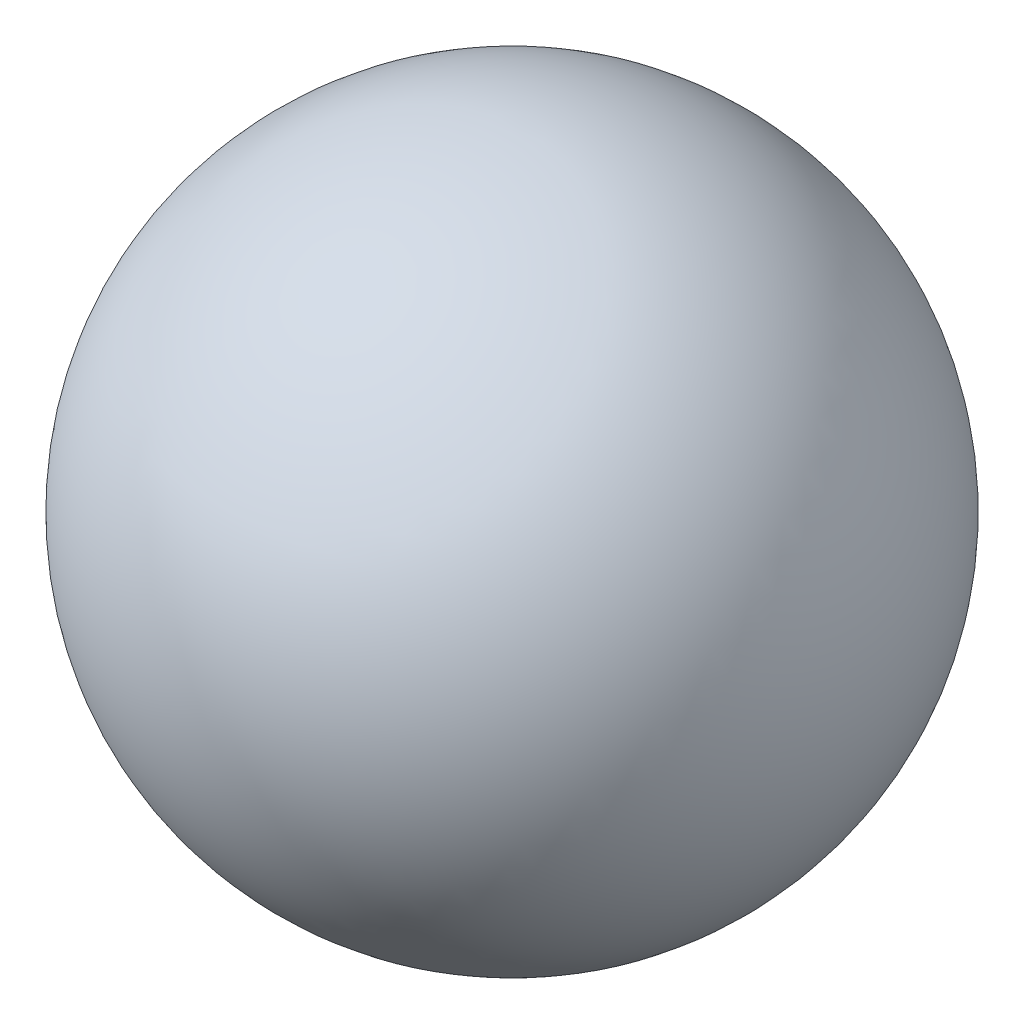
SolidWorks part; units mm, degrees
ref_plane "Front Plane" through (0, 0, 0) normal (0, 0, 1) x (1, 0, 0)
ref_plane "Top Plane" through (0, 0, 0) normal (0, 1, 0) x (1, 0, 0)
ref_plane "Right Plane" through (0, 0, 0) normal (1, 0, 0) x (0, 0, -1)
sketch "Sketch1" plane through (0, 0, 0) normal (0, 0, 1) x (1, 0, 0)
  line L0 (0, 32.639) -> (0, -32.639)
  arc A0 (0, 32.639) -> (0, -32.639) centre (0, 0) cw
  dimension "D1" = 32.639
revolve "Revolve1" add sketch "Sketch1" angle 360 about L0
